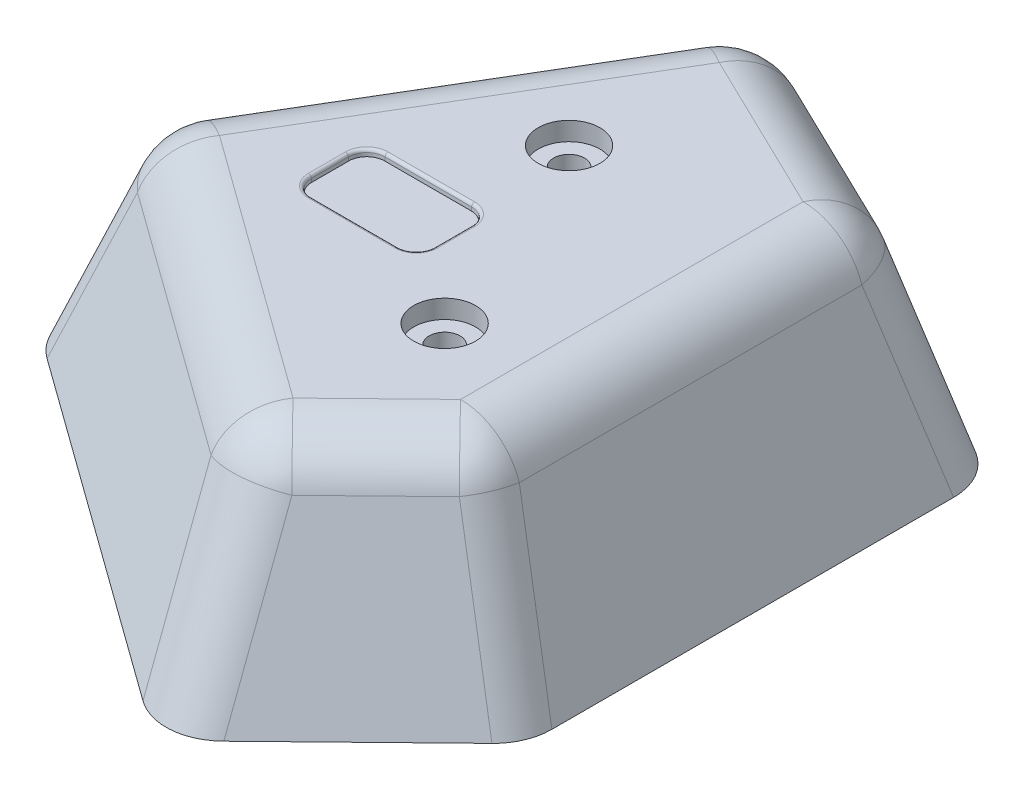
SolidWorks part; units mm, degrees
ref_plane "Front Plane" through (0, 0, 0) normal (0, 0, 1) x (1, 0, 0)
ref_plane "Top Plane" through (0, 0, 0) normal (0, 1, 0) x (1, 0, 0)
ref_plane "Right Plane" through (0, 0, 0) normal (1, 0, 0) x (0, 0, -1)
sketch "Sketch1" plane through (0, 0, 0) normal (0, 1, 0) x (1, 0, 0)
  line L0 (0, 0) -> (52.194, -25.2451)
  line L1 (52.194, -25.2451) -> (52.194, -100.2451)
  line L2 (52.194, -100.2451) -> (21.5835, -130)
  line L3 (21.5835, -130) -> (-47.7124, -80)
  line L4 (-47.7124, -80) -> (0, 0)
  dimension "D1" = 80
  dimension "D2" = 50
  dimension "D3" = 95
  dimension "D4" = 95
  dimension "D5" = 100
  dimension "D6" = 75
  dimension "D7" = 52.194
extrude "Boss-Extrude1" add sketch "Sketch1" along normal blind 35 draft 18 contours L4 L0 L1 L2 L3
fillet "Fillet4" radius 10 10 edges at (-14.0892, 35, 45.8251) (22.6256, 35, 23.5761) (40.8218, 35, 63.9086) (30.6606, 35, 105.3171) (-6.0541, 35, 96.0348) (2.2147, 17.5, 7.3875) (46.5079, 17.5, 28.8112) (46.5079, 17.5, 97.8425) (21.0415, 17.5, 122.5971) (-40.16, 17.5, 78.4376)
sketch "Sketch2" plane through (0, 35, 0) normal (0, 1, 0) x (1, 0, 0)
  line L0 (0, 0) -> (6.746, -48) construction
  line L1 (6.746, -48) -> (21.6026, -83) construction
  line L2 (0, 0) -> (0, -37.9423) construction
  circle A0 centre (6.746, -48) radius 2.5
  circle A1 centre (21.6026, -83) radius 2.5
  dimension "D1" = 5
  dimension "D2" = 48
  dimension "D3" = 35
  dimension "D4" = 8
  dimension "D5" = 165
extrude "Cut-Extrude1" cut sketch "Sketch2" against normal through all
sketch "Sketch3" plane through (0, 35, 0) normal (0, 1, 0) x (1, 0, 0)
  circle A2 centre (6.746, -48) radius 5
  circle A3 centre (21.6026, -83) radius 5
  circle A4 centre (6.746, -48) radius 2.5 construction
  circle A6 centre (21.6026, -83) radius 2.5 construction
  dimension "D1" = 10
extrude "Cut-Extrude2" cut sketch "Sketch3" against normal blind 3
sketch "Sketch4" plane through (0, 35, 0) normal (0, 1, 0) x (1, 0, 0)
  line L1 (-7, -64) -> (7, -64)
  line L2 (-10, -67) -> (-10, -73)
  line L3 (-7, -76) -> (7, -76)
  line L4 (10, -67) -> (10, -73)
  arc A0 (-10, -73) -> (-7, -76) centre (-7, -73) ccw
  arc A1 (7, -76) -> (10, -73) centre (7, -73) ccw
  arc A2 (7, -64) -> (10, -67) centre (7, -67) cw
  arc A3 (-7, -64) -> (-10, -67) centre (-7, -67) ccw
  point P7 (-10, -76)
  point P10 (10, -76)
  point P15 (-10, -64)
  dimension "D5" = 3
  dimension "D1" = 10
  dimension "D2" = 20
  dimension "D3" = 12
  dimension "D4" = 64
extrude "Cut-Extrude3" cut sketch "Sketch4" against normal blind 1 draft 5
fillet "Fillet6" radius 0.5 8 edges at (10, 35, 70) (9.1213, 35, 75.1213) (0, 35, 76) (-9.1213, 35, 75.1213) (-10, 35, 70) (-9.1213, 35, 64.8787) (0, 35, 64) (9.1213, 35, 64.8787)
